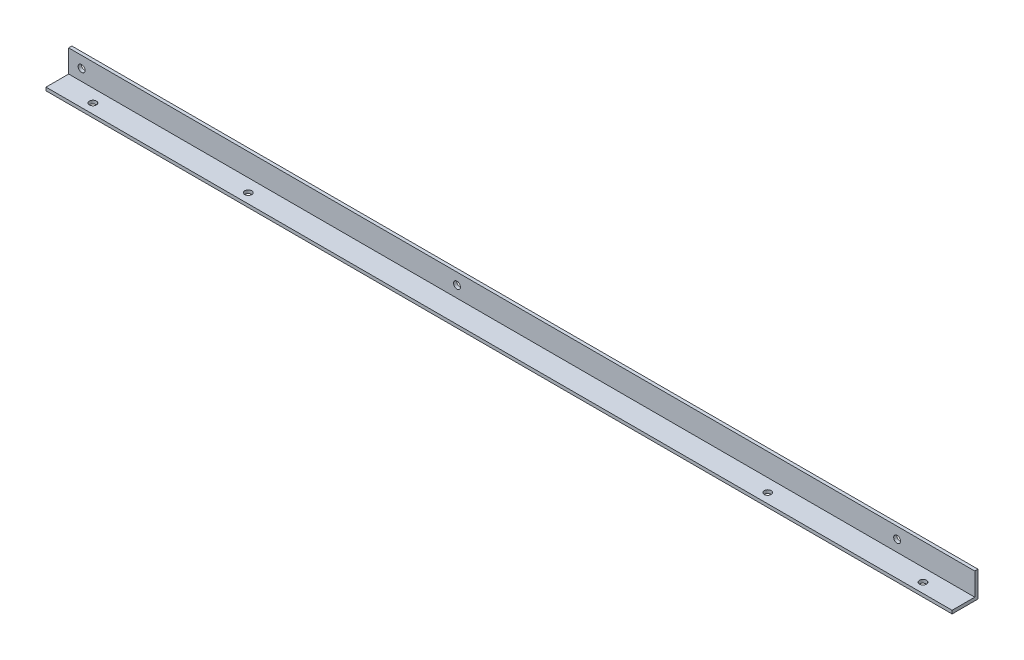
SolidWorks part; units mm, degrees
ref_plane "Front Plane" through (0, 0, 0) normal (0, 0, 1) x (1, 0, 0)
ref_plane "Top Plane" through (0, 0, 0) normal (0, 1, 0) x (1, 0, 0)
ref_plane "Right Plane" through (0, 0, 0) normal (1, 0, 0) x (0, 0, -1)
sketch "Sketch1" plane through (0, 0, 0) normal (0, 1, 0) x (1, 0, 0)
  line L1 (-444.5, 12.7) -> (444.5, 12.7)
  line L2 (-444.5, 12.7) -> (-444.5, -12.7)
  line L3 (-444.5, -12.7) -> (444.5, -12.7)
  line L4 (444.5, 12.7) -> (444.5, -12.7)
  line L5 (-444.5, 12.7) -> (444.5, -12.7) construction
  line L6 (-444.5, -12.7) -> (444.5, 12.7) construction
  point P0 (0, 0)
  dimension "D1" = 889
  dimension "D2" = 25.4
extrude "Boss-Extrude1" add sketch "Sketch1" along normal blind 3.175
sketch "Sketch2" plane through (0, 3.175, 0) normal (0, 1, 0) x (1, 0, 0)
  line L0 (-444.5, 12.7) -> (-444.5, 9.525)
  line L1 (-444.5, 12.7) -> (-444.5, -12.7) construction
  line L2 (-444.5, 9.525) -> (444.5, 9.525)
  line L3 (444.5, -12.7) -> (444.5, 12.7) construction
  line L4 (444.5, 9.525) -> (444.5, 12.7)
  line L5 (444.5, 12.7) -> (-444.5, 12.7)
  dimension "D1" = 3.175
extrude "Boss-Extrude2" add sketch "Sketch2" along normal blind 22.225
sketch "Sketch3" plane through (0, 3.175, 0) normal (0, 1, 0) x (1, 0, 0)
  line L0 (-444.5, -3.175) -> (444.5, -3.175) construction
  line L1 (-444.5, 9.525) -> (-444.5, -12.7) construction
  line L2 (444.5, -12.7) -> (444.5, 9.525) construction
  line L3 (-444.5, -12.7) -> (444.5, -12.7) construction
  circle A0 centre (-407.9875, -3.175) radius 3.3782
  circle A1 centre (-255.5875, -3.175) radius 3.3782
  circle A2 centre (406.4, -3.175) radius 3.3782
  circle A3 centre (254, -3.175) radius 3.3782
  dimension "D2" = 6.7564
  dimension "D3" = 6.7564
  dimension "D4" = 6.7564
  dimension "D5" = 6.7564
  dimension "D1" = 9.525
  dimension "D6" = 36.5125
  dimension "D7" = 152.4
  dimension "D8" = 38.1
  dimension "D9" = 152.4
extrude "Cut-Extrude1" cut sketch "Sketch3" against normal through all
sketch "Sketch4" plane through (0, 0, -9.525) normal (0, 0, 1) x (1, 0, 0)
  line L0 (-444.5, 14.2875) -> (444.5, 14.2875) construction
  line L1 (-444.5, 25.4) -> (-444.5, 3.175) construction
  line L2 (444.5, 25.4) -> (444.5, 3.175) construction
  line L3 (-444.5, 25.4) -> (444.5, 25.4) construction
  circle A0 centre (368.3, 14.2875) radius 3.3782
  circle A1 centre (-63.5, 14.2875) radius 3.3782
  circle A2 centre (-431.8, 14.2875) radius 3.3782
  dimension "D2" = 6.7564
  dimension "D6" = 6.7564
  dimension "D7" = 6.7564
  dimension "D1" = 11.1125
  dimension "D3" = 76.2
  dimension "D4" = 12.7
  dimension "D5" = 381
extrude "Cut-Extrude2" cut sketch "Sketch4" against normal through all
